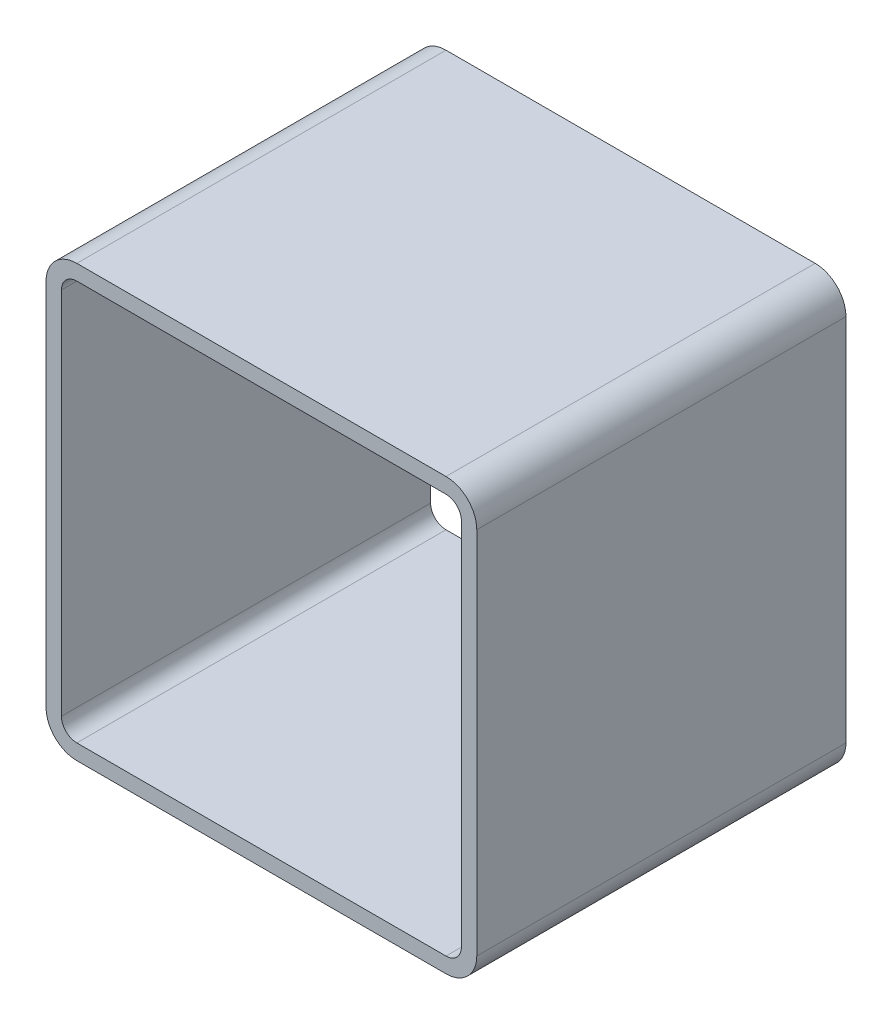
SolidWorks part; units mm, degrees
ref_plane "Front Plane" through (0, 0, 0) normal (0, 0, 1) x (1, 0, 0)
ref_plane "Top Plane" through (0, 0, 0) normal (0, 1, 0) x (1, 0, 0)
ref_plane "Right Plane" through (0, 0, 0) normal (1, 0, 0) x (0, 0, -1)
sketch "Sketch1" plane through (0, 0, 0) normal (0, 0, 1) x (1, 0, 0)
sketch_block_instance "HSS14x14x0.500-1"
sketch_block "HSS14x14x0.500"
extrude "Boss-Extrude1" add sketch "Sketch1" along normal blind 304.8
